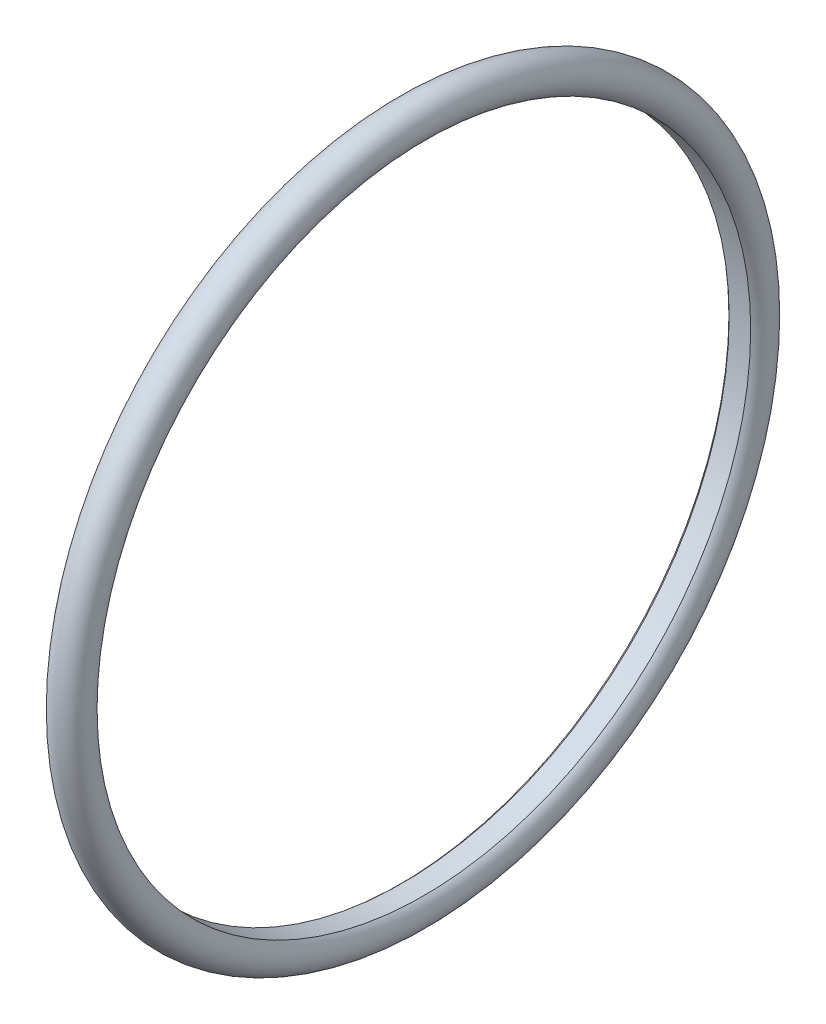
SolidWorks part; units mm, degrees
ref_plane "Plan de face" through (0, 0, 0) normal (0, 0, 1) x (1, 0, 0)
ref_plane "Plan de dessus" through (0, 0, 0) normal (0, 1, 0) x (1, 0, 0)
ref_plane "Plan de droite" through (0, 0, 0) normal (1, 0, 0) x (0, 0, -1)
sketch "Esquisse1" plane through (0, 0, 0) normal (0, 0, 1) x (1, 0, 0)
  line L0 (0, 0) -> (0, 67.0715) construction
  line L1 (0, 0) -> (44.0032, 0) construction
  circle A0 centre (0, 9.5) radius 0.5
  dimension "D2" = 1
  dimension "D1" = 9.5
revolve "Révolution1" add sketch "Esquisse1" angle 360 about L1
sketch "Esquisse2" plane through (0, 0, 0) normal (1, 0, 0) x (0, 0, -1)
  circle A0 centre (0, 0) radius 9.1
  dimension "D1" = 18.2
extrude "Enlèv. mat.-Extru.1" cut sketch "Esquisse2" against normal through all and the other way through all
